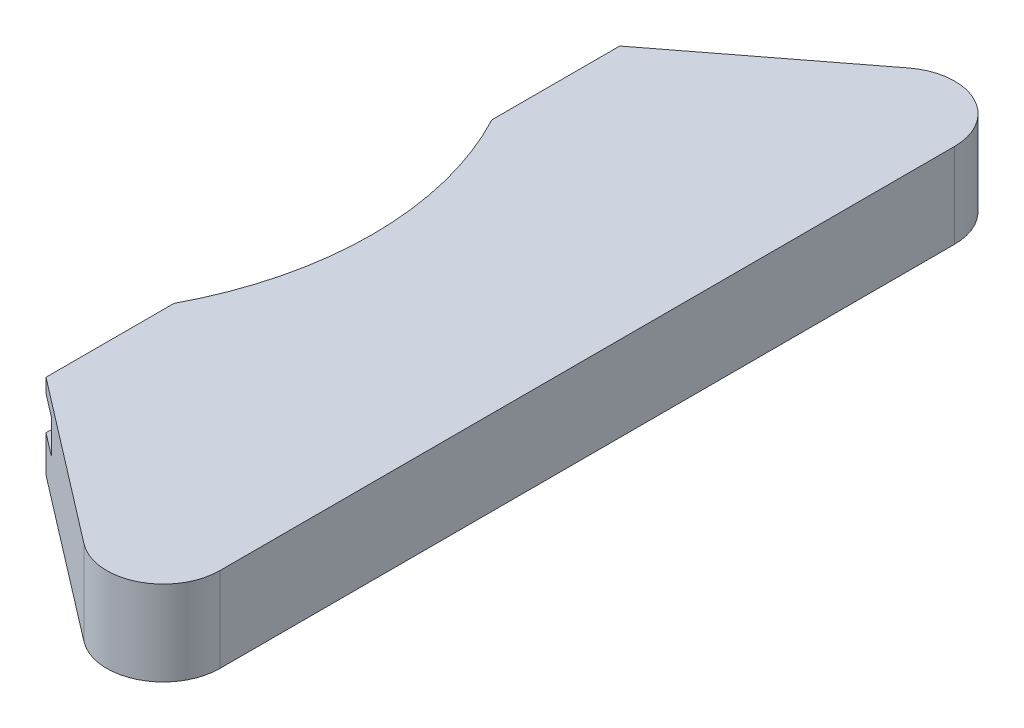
SolidWorks part; units mm, degrees
ref_plane "Vorder" through (0, 0, 0) normal (0, 0, 1) x (1, 0, 0)
ref_plane "Drauf" through (0, 0, 0) normal (0, 1, 0) x (1, 0, 0)
ref_plane "Seite" through (0, 0, 0) normal (1, 0, 0) x (0, 0, -1)
ref_plane "Ebene2" through (0, 2, 0) normal (0, 1, 0) x (-1, 0, 0)
sketch "Skizze1" plane through (0, 0, 0) normal (0, 1, 0) x (1, 0, 0)
  line L0 (-45, -28.1247) -> (-45, -50.7483)
  line L1 (-45, -50.7483) -> (-16.0876, -72.9335)
  line L2 (0, -65) -> (0, 65)
  line L3 (0, 0) -> (-44.601, 0) construction
  line L4 (-45, 50.7483) -> (-16.0876, 72.9335)
  line L5 (-45, 28.1247) -> (-45, 50.7483)
  arc A0 (-16.0876, -72.9335) -> (0, -65) centre (-10, -65) ccw
  arc A1 (-45, -28.1247) -> (-45, 28.1247) centre (-98, 0) ccw
  arc A2 (-16.0876, 72.9335) -> (0, 65) centre (-10, 65) cw
  dimension "D1" = 38
  dimension "D3" = 10
  dimension "D5" = 60
  dimension "D6" = 130
  dimension "D2" = 75
  dimension "D4" = 45
extrude "Linear austragen1" add sketch "Skizze1" along normal mid plane 15
sketch "Skizze2" plane through (0, 2, 0) normal (0, 1, 0) x (1, 0, 0)
  line L0 (-56.2653, -30.5331) -> (-41.7765, -34.4154)
  line L1 (-41.7765, -34.4154) -> (-41, -31.5176)
  line L2 (-41, -31.5176) -> (-55.4889, -27.6353)
  line L3 (-55.4889, -27.6353) -> (-56.2653, -30.5331)
  line L4 (-41.7765, -34.4154) -> (-26.1927, -38.591) construction
  line L5 (-45, -28.1247) -> (-45, -50.7483) construction
  line L6 (-41, -31.5176) -> (-41, -53.8176) construction
  line L7 (-45, -50.7483) -> (-16.0876, -72.9335) construction
  dimension "D1" = 105
  dimension "D2" = 22.3
  dimension "D3" = 3
  dimension "D4" = 4
  dimension "D5" = 15
revolve "Schnitt-Rotation1" cut sketch "Skizze2" angle 180 about L4
ref_plane "Ebene1" through (-41, 0, 0) normal (-1, 0, 0) x (0, 0, 1)
sketch "Skizze5" plane through (-30.3741, 0, -8.1387) normal (-0.9659, 0, -0.2588) x (-0.2588, 0, 0.9659)
  line L1 (44.0552, -1) -> (44.0552, 5)
  line L2 (44.0552, -1) -> (44.0552, 5)
  arc A1 (44.0552, 5) -> (44.0552, -1) centre (44.0552, 2) ccw
  arc A2 (44.0552, 5) -> (44.0552, -1) centre (44.0552, 2) ccw
  dimension "D1" = 0
extrude "Schnitt-Linear austragen2" cut sketch "Skizze5" against normal up to surface (0.8038 mm away)
sketch "Skizze6" plane through (0, 2, 0) normal (0, 1, 0) x (-1, 0, 0)
  line L0 (41, 53.8176) -> (41, 34.6234)
  line L1 (41, 34.6234) -> (45, 33.5516) construction
  line L2 (41, 34.6234) -> (45, 33.5516)
  line L3 (41, -8.25) -> (41, 8.25) construction
  line L4 (45, 50.7483) -> (16.0876, 72.9335) construction
  line L5 (45, 28.1247) -> (45, 50.7483) construction
  line L6 (45, 50.7483) -> (41, 53.8176)
  line L7 (45, 33.5516) -> (45, 50.7483)
extrude "Schnitt-Linear austragen3" cut sketch "Skizze6" against normal up to vertex and the other way up to vertex
